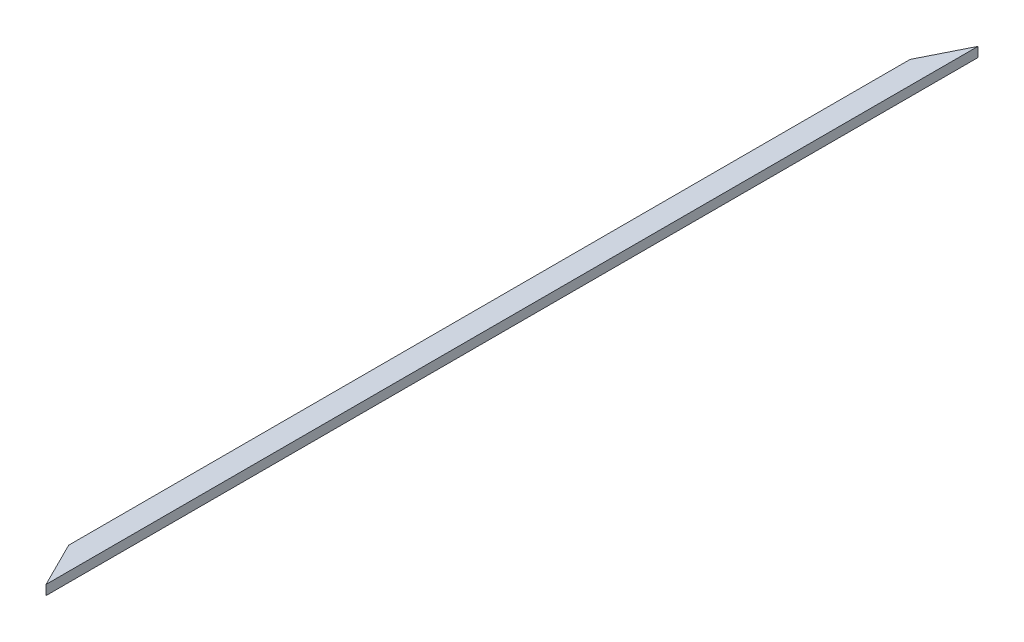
SolidWorks part; units mm, degrees
ref_plane "Front Plane" through (0, 0, 0) normal (0, 0, 1) x (1, 0, 0)
ref_plane "Top Plane" through (0, 0, 0) normal (0, 1, 0) x (1, 0, 0)
ref_plane "Right Plane" through (0, 0, 0) normal (1, 0, 0) x (0, 0, -1)
sketch "Sketch1" plane through (0, 0, 0) normal (0, 1, 0) x (1, 0, 0)
  line L0 (0, 0) -> (0, -3657.6)
  line L1 (0, -3657.6) -> (-88.9, -3479.8384)
  line L2 (-88.9, -3479.8384) -> (-88.9, -177.7616)
  line L3 (-88.9, -177.7616) -> (0, 0)
  line L4 (0, 0) -> (-875.8901, 0) construction
  dimension "D1" = 3657.6
  dimension "D2" = 63.43
  dimension "D3" = 88.9
extrude "Boss-Extrude1" add sketch "Sketch1" along normal blind 38.1
